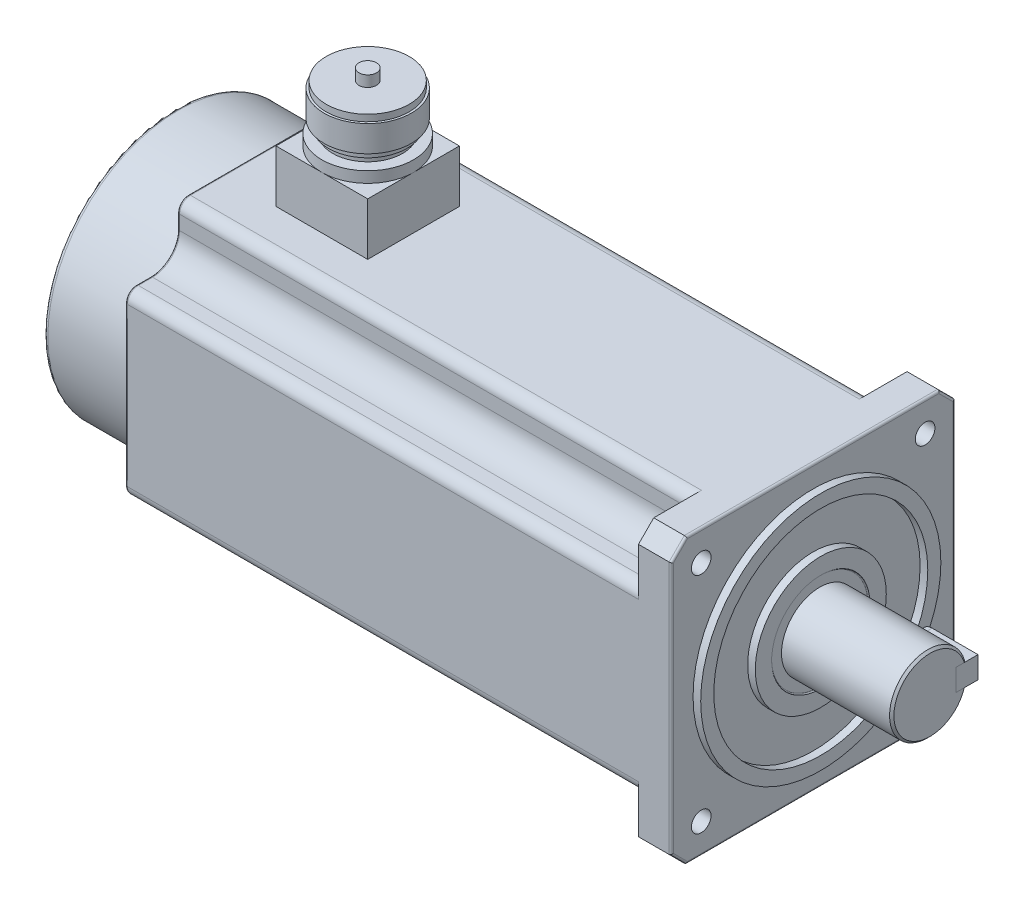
SolidWorks part; units mm, degrees
ref_plane "前视基准面" through (0, 0, 0) normal (0, 0, 1) x (1, 0, 0)
ref_plane "上视基准面" through (0, 0, 0) normal (0, 1, 0) x (1, 0, 0)
ref_plane "右视基准面" through (0, 0, 0) normal (1, 0, 0) x (0, 0, -1)
sketch "草图1" plane through (0, 0, 0) normal (1, 0, 0) x (0, 0, -1)
  line L0 (-65, 58) -> (-58, 65)
  line L1 (-58, -65) -> (58, -65)
  line L2 (-65, -58) -> (-65, 58)
  line L3 (-58, 65) -> (58, 65)
  line L4 (65, -58) -> (65, 58)
  line L5 (-65, -65) -> (65, 65) construction
  line L6 (-65, 65) -> (65, -65) construction
  line L7 (-58, -65) -> (-65, -58)
  line L8 (58, -65) -> (65, -58)
  line L9 (65, 58) -> (58, 65)
  point P0 (0, 0)
extrude "凸台-拉伸1" add sketch "草图1" against normal blind 250
sketch "草图2" plane through (-250, 0, 0) normal (-1, 0, 0) x (0, 0, 1)
  line L0 (-53.5, 41.1509) -> (-60, 41.1509)
  line L1 (-36.1509, 65) -> (-58, 65)
  line L2 (-41.1509, 53.5) -> (-41.1509, 60)
  line L3 (-58, 65) -> (58, 65) construction
  line L4 (-58, 65) -> (-65, 58)
  line L5 (41.1509, 60) -> (41.1509, 53.5)
  line L6 (-65, 58) -> (-58, 65) construction
  line L7 (-65, -58) -> (-65, 58) construction
  line L8 (53.5, 41.1509) -> (60, 41.1509)
  line L9 (-60, -41.1509) -> (-53.5, -41.1509)
  line L10 (-41.1509, -53.5) -> (-41.1509, -60)
  line L11 (58, -65) -> (-58, -65) construction
  line L12 (65, 58) -> (65, -58) construction
  line L13 (-65, 58) -> (-65, 36.1509)
  line L14 (60, -41.1509) -> (53.5, -41.1509)
  line L15 (-65, -36.1509) -> (-65, -58)
  line L16 (41.1509, -53.5) -> (41.1509, -60)
  line L17 (-65, -58) -> (-58, -65)
  line L18 (-58, -65) -> (-36.1509, -65)
  line L19 (36.1509, -65) -> (58, -65)
  line L20 (58, -65) -> (65, -58)
  line L21 (65, -58) -> (65, -36.1509)
  line L22 (65, 36.1509) -> (65, 58)
  line L23 (65, 58) -> (58, 65)
  line L24 (58, 65) -> (36.1509, 65)
  arc A0 (-53.5, 41.1509) -> (-41.1509, 53.5) centre (-53.5, 53.5) ccw
  arc A1 (41.1509, 53.5) -> (53.5, 41.1509) centre (53.5, 53.5) ccw
  arc A2 (53.5, -41.1509) -> (41.1509, -53.5) centre (53.5, -53.5) ccw
  arc A3 (-41.1509, -53.5) -> (-53.5, -41.1509) centre (-53.5, -53.5) ccw
  arc A4 (-41.1509, 60) -> (-36.1509, 65) centre (-36.1509, 60) cw
  arc A5 (36.1509, 65) -> (41.1509, 60) centre (36.1509, 60) cw
  arc A6 (60, 41.1509) -> (65, 36.1509) centre (60, 36.1509) cw
  arc A7 (65, -36.1509) -> (60, -41.1509) centre (60, -36.1509) cw
  arc A8 (36.1509, -65) -> (41.1509, -60) centre (36.1509, -60) ccw
  arc A9 (-36.1509, -65) -> (-41.1509, -60) centre (-36.1509, -60) cw
  arc A10 (-60, -41.1509) -> (-65, -36.1509) centre (-60, -36.1509) cw
  arc A11 (-65, 36.1509) -> (-60, 41.1509) centre (-60, 36.1509) cw
  point P0 (0, 0)
  point P10 (-41.1509, 65)
  point P39 (41.1509, 65)
  point P42 (65, 41.1509)
  point P45 (65, -41.1509)
  point P48 (41.1509, -65)
  point P51 (-41.1509, -65)
  point P54 (-65, -41.1509)
  point P57 (-65, 41.1509)
  dimension "D1" = 5
extrude "切除-拉伸1" cut sketch "草图2" against normal blind 235
fillet "圆角1" radius 1 8 edges at (0, 61.5, -61.5) (0, 0, -65) (0, -61.5, -61.5) (0, -65, 0) (0, -61.5, 61.5) (0, 0, 65) (0, 61.5, 61.5) (0, 65, 0)
fillet "圆角2" radius 1 24 edges at (-250, -44.7679, 44.7679) (-250, -56.75, 41.1509) (-250, -63.5355, 39.6864) (-250, -65, 0) (-250, -63.5355, -39.6864) (-250, -56.75, -41.1509) (-250, -44.7679, -44.7679) (-250, -41.1509, -56.75) (-250, -39.6864, -63.5355) (-250, 0, -65) (-250, 39.6864, -63.5355) (-250, 41.1509, -56.75) (-250, 44.7679, -44.7679) (-250, 56.75, -41.1509) (-250, 63.5355, -39.6864) (-250, 65, 0) (-250, 63.5355, 39.6864) (-250, 56.75, 41.1509) (-250, 44.7679, 44.7679) (-250, 41.1509, 56.75) (-250, 39.6864, 63.5355) (-250, 0, 65) (-250, -39.6864, 63.5355) (-250, -41.1509, 56.75)
sketch "草图3" plane through (-250, 0, 0) normal (-1, 0, 0) x (0, 0, 1)
  circle A0 centre (0, 0) radius 60
extrude "凸台-拉伸2" add sketch "草图3" along normal blind 42.5
fillet "圆角3" radius 2 1 edges at (-292.5, 0, 60)
sketch "草图4" plane through (0, 0, 0) normal (1, 0, 0) x (0, 0, -1)
  circle A0 centre (-51.2652, 51.2652) radius 4.5
  circle A1 centre (51.2652, 51.2652) radius 4.5
  circle A2 centre (51.2652, -51.2652) radius 4.5
  circle A3 centre (-51.2652, -51.2652) radius 4.5
  point P11 (-51.2652, 51.2652)
  point P12 (-51.2652, -51.2652)
  point P13 (51.2652, -51.2652)
  point P14 (51.2652, 51.2652)
extrude "切除-拉伸2" cut sketch "草图4" against normal blind 15
sketch "草图5" plane through (0, 0, 0) normal (1, 0, 0) x (0, 0, -1)
  circle A0 centre (0, 0) radius 55
  circle A1 centre (0, 0) radius 49
extrude "凸台-拉伸3" add sketch "草图5" along normal blind 3.5 separate body
sketch "草图6" plane through (0, 0, 0) normal (1, 0, 0) x (0, 0, -1)
  circle A0 centre (0, 0) radius 30
extrude "凸台-拉伸4" add sketch "草图6" along normal blind 3.5
sketch "草图7" plane through (3.5, 0, 0) normal (1, 0, 0) x (0, 0, -1)
  circle A0 centre (0, 0) radius 22.5
extrude "切除-拉伸3" cut sketch "草图7" against normal blind 0.5
sketch "草图8" plane through (3, 0, 0) normal (1, 0, 0) x (0, 0, -1)
  circle A0 centre (0, 0) radius 17.5
extrude "凸台-拉伸5" add sketch "草图8" along normal blind 50.5
fillet "圆角4" radius 0.5 1 edges at (3, 0, -22.5)
ref_plane "基准面1" through (0, 0, -17.5) normal (0, 0, 1) x (1, 0, 0)
sketch "草图9" plane through (0, 0, -17.5) normal (0, 0, 1) x (1, 0, 0)
  line L1 (53.5, -17.5) -> (53.5, 17.5) construction
  line L2 (32.5, 5) -> (53.5, 5)
  line L3 (53.5, 5) -> (53.5, -5)
  line L4 (53.5, -5) -> (32.5, -5)
  arc A0 (32.5, 5) -> (32.5, -5) centre (32.5, 0) ccw
extrude "切除-拉伸5" cut sketch "草图9" along normal blind 5.5
sketch "草图10" plane through (0, 0, -12) normal (0, 0, -1) x (-1, 0, 0)
  line L0 (-32.5, 5) -> (-53.5, 5)
  line L1 (-53.5, 5) -> (-53.5, -5)
  line L2 (-53.5, -5) -> (-32.5, -5)
  arc A0 (-32.5, -5) -> (-32.5, 5) centre (-32.5, 0) ccw
extrude "凸台-拉伸6" add sketch "草图10" along normal blind 10 separate body
chamfer "倒角1" distance 1 angle 45 1 edges at (53.5, 0, 17.5)
sketch "草图28" plane through (0, 65, 0) normal (0, 1, 0) x (1, 0, 0)
  line L3 (-225, -21) -> (-183, -21)
  line L4 (-225, -21) -> (-225, 21)
  line L5 (-225, 21) -> (-183, 21)
  line L6 (-183, -21) -> (-183, 21)
  line L7 (-225, -21) -> (-183, 21) construction
  line L8 (-225, 21) -> (-183, -21) construction
extrude "凸台-拉伸21" add sketch "草图28" along normal blind 24
sketch "草图29" plane through (0, 89, 0) normal (0, 1, 0) x (1, 0, 0)
  circle A0 centre (-204, 0) radius 21
extrude "凸台-拉伸22" add sketch "草图29" along normal blind 5
sketch "草图30" plane through (0, 94, 0) normal (0, 1, 0) x (1, 0, 0)
  circle A0 centre (-204, 0) radius 16
extrude "凸台-拉伸23" add sketch "草图30" along normal blind 3
sketch "草图31" plane through (0, 97, 0) normal (0, 1, 0) x (1, 0, 0)
  circle A0 centre (-204, 0) radius 18
extrude "凸台-拉伸24" add sketch "草图31" along normal blind 3
sketch "草图32" plane through (0, 100, 0) normal (0, 1, 0) x (1, 0, 0)
  circle A0 centre (-204, 0) radius 20
extrude "凸台-拉伸25" add sketch "草图32" along normal blind 12
sketch "草图33" plane through (0, 112, 0) normal (0, 1, 0) x (1, 0, 0)
  circle A0 centre (-204, 0) radius 19
extrude "凸台-拉伸26" add sketch "草图33" along normal blind 3
sketch "草图34" plane through (0, 115, 0) normal (0, 1, 0) x (1, 0, 0)
  circle A0 centre (-204, 0) radius 4
extrude "凸台-拉伸27" add sketch "草图34" along normal blind 5
